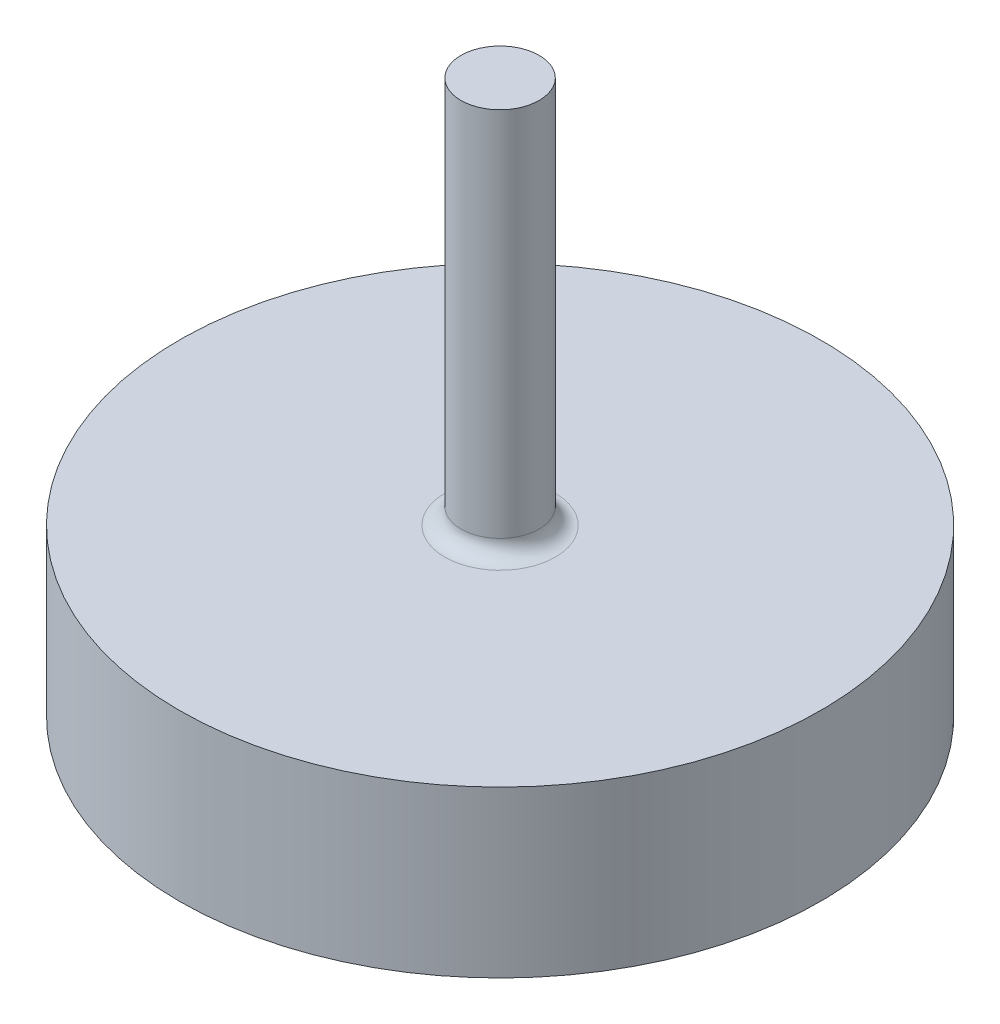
SolidWorks part; units mm, degrees
ref_plane "Frontal Plane" through (0, 0, 0) normal (0, 0, 1) x (1, 0, 0)
ref_plane "Horizontal Plane" through (0, 0, 0) normal (0, 1, 0) x (1, 0, 0)
ref_plane "Profile Plane" through (0, 0, 0) normal (1, 0, 0) x (0, 0, -1)
sketch "Sketch1" plane through (0, 0, 0) normal (0, 0, 1) x (1, 0, 0)
  line L0 (0, 0) -> (0, -43.307)
  line L1 (0, -43.307) -> (-25.1333, -43.307)
  line L2 (-25.1333, -43.307) -> (-25.1333, -30.353)
  line L3 (-25.1333, -30.353) -> (-3.0607, -30.353)
  line L4 (-3.0607, -30.353) -> (-3.0607, 0)
  line L5 (-3.0607, 0) -> (0, 0)
  line L6 (0, 34.9965) -> (0, -93.1373) construction
  dimension "D1" = 25.1333
  dimension "D2" = 22.0726
  dimension "D3" = 12.954
  dimension "D4" = 43.307
revolve "Revolve1" add sketch "Sketch1" angle 360 about L6
fillet "Fillet1" radius 1.27 1 edges at (0, -30.353, 3.0607)
